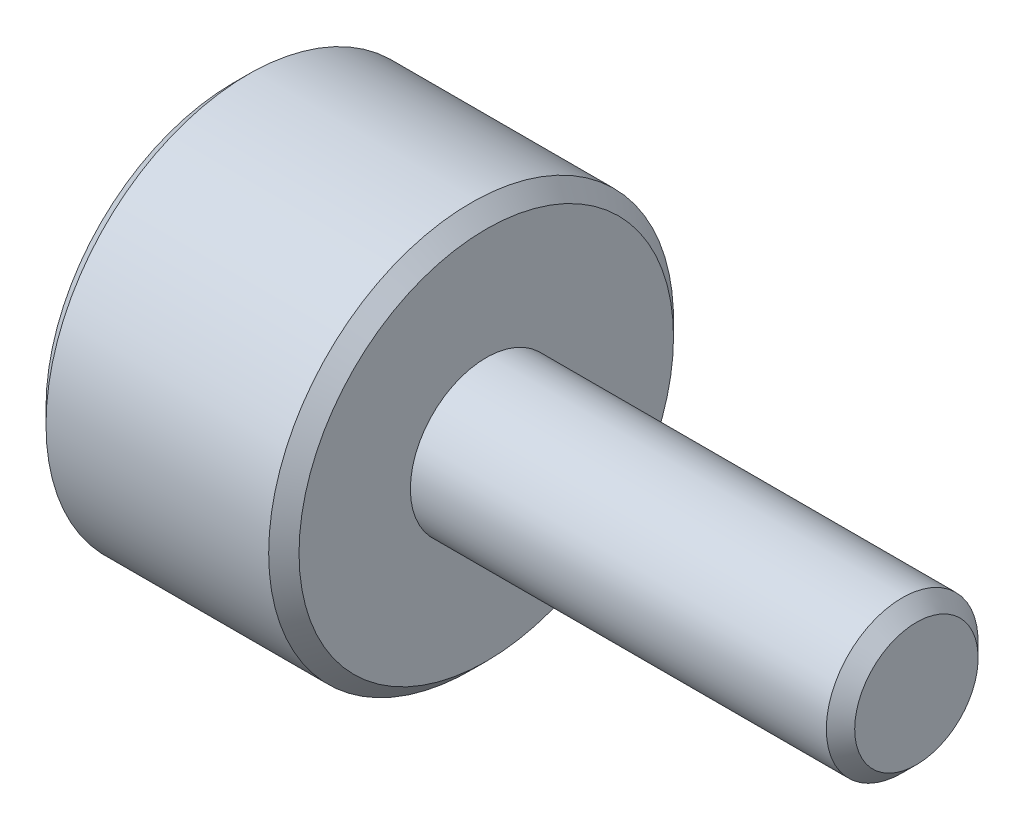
SolidWorks part; units mm, degrees
ref_plane "Plane1" through (0, 0, 0) normal (0, 0, 1) x (1, 0, 0)
ref_plane "Plane2" through (0, 0, 0) normal (0, 1, 0) x (1, 0, 0)
ref_plane "Plane3" through (0, 0, 0) normal (1, 0, 0) x (0, 0, -1)
sketch "BodySke" plane through (0, 0, 0) normal (0, 0, 1) x (1, 0, 0)
  line L0 (13.2195, 1.5) -> (13.5, 1.2195)
  line L1 (0, 0) -> (0, 3.7)
  line L2 (-25.4, 0) -> (47.8798, 0) construction
  line L3 (13.5, 0) -> (0, 0)
  line L5 (13.5, 1.2195) -> (13.5, 0)
  line L6 (0.3, 4) -> (4.7, 4)
  line L7 (2.5, 31.75) -> (2.5, -6.35) construction
  line L8 (0.3, 4) -> (0, 3.7)
  line L9 (5.5, 6.5875) -> (5.5, -2.9375) construction
  line L10 (5.5, 6.35) -> (5.5, -3.175) construction
  line L11 (4.7, 4) -> (5, 3.7)
  line L14 (5, 1.5) -> (13.2195, 1.5)
  line L15 (5, 1.5) -> (5, 3.7)
  point P9 (13.5, 1.5)
  dimension "D1" = 45
  dimension "D3" = 45
  dimension "Head_ht" = 5
  dimension "Head_dia" = 8
  dimension "Advance" = 0.5
  dimension "Thread_nom" = 8
  dimension "Chamfer" = 0.3
  dimension "diameter" = 3
  dimension "Minor_dia" = 2.439
revolve "Base-Revolve" add sketch "BodySke" angle 360 about L2
equation "\"Thread_minor@ThreadCosmetic\" = \"Minor_dia@BodySke\""
